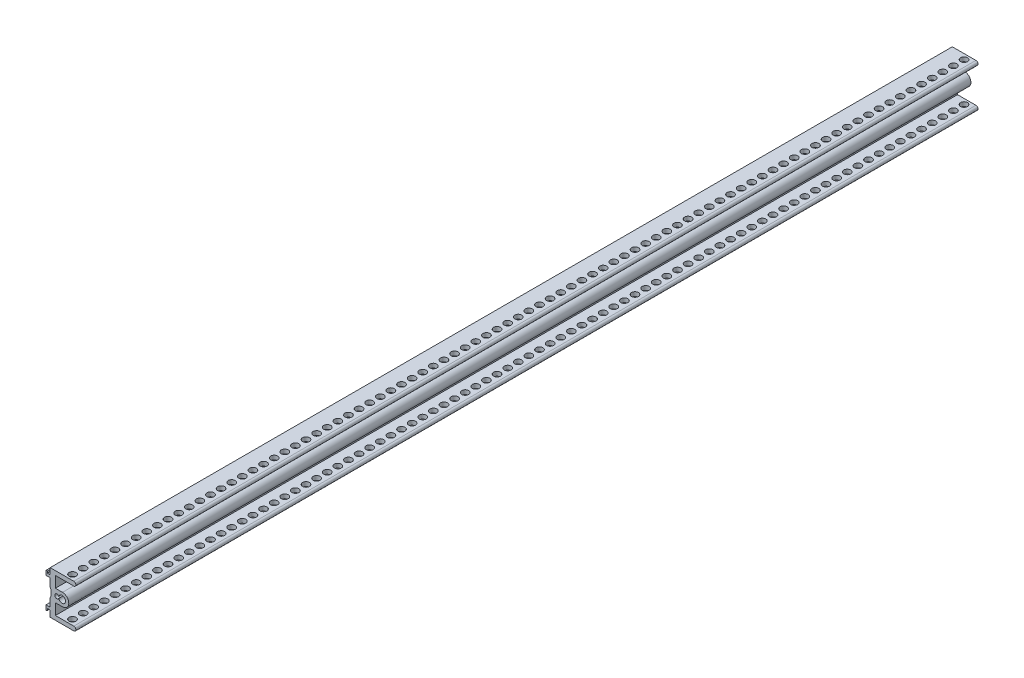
SolidWorks part; units mm, degrees
ref_plane "前视基准面" through (0, 0, 0) normal (0, 0, 1) x (1, 0, 0)
ref_plane "上视基准面" through (0, 0, 0) normal (0, 1, 0) x (1, 0, 0)
ref_plane "右视基准面" through (0, 0, 0) normal (1, 0, 0) x (0, 0, -1)
sketch "草图1" plane through (0, 0, 0) normal (0, 0, 1) x (1, 0, 0)
  line L0 (-4.15, 8.3) -> (-4.15, 3)
  line L1 (-6.65, 10.3) -> (4.65, 10.3)
  line L2 (-6.65, 7.3) -> (-8.05, 7.3)
  line L3 (4.65, 8.3) -> (-4.15, 8.3)
  line L4 (-6.65, -6.1) -> (-6.65, -2.0884)
  line L5 (-6.65, 2.1116) -> (-6.35, 1.5116)
  line L6 (-0.75, 0) -> (3.3598, 0) construction
  line L7 (-6.65, -7.3) -> (-6.65, -10.3)
  line L8 (-8.65, -8.0782) -> (-8.65, -6.1)
  line L9 (-6.65, -6.1) -> (-8.65, -6.1)
  line L10 (-8.05, -8.0782) -> (-8.05, -7.3)
  line L11 (-6.65, -2.0884) -> (-6.35, -1.4884)
  line L12 (-6.65, 2.1116) -> (-6.65, 6.1)
  line L13 (4.65, -8.3) -> (-4.15, -8.3)
  line L14 (-6.65, -10.3) -> (4.65, -10.3)
  line L15 (-4.15, -8.3) -> (-4.15, -3)
  line L16 (-6.35, 1.5116) -> (-6.35, -1.4884)
  line L17 (-4.15, 3) -> (-0.75, 3)
  line L18 (-8.05, 8.0782) -> (-8.05, 7.3)
  line L19 (-0.75, -3) -> (-4.15, -3)
  line L20 (-6.65, 6.1) -> (-8.65, 6.1)
  line L21 (-8.65, 8.0782) -> (-8.65, 6.1)
  line L22 (-6.65, -7.3) -> (-8.05, -7.3)
  line L23 (-8.35, -8.3782) -> (-9.7583, -8.3782) construction
  line L24 (-8.35, 8.3782) -> (-9.5309, 8.3782) construction
  line L25 (-6.65, 7.3) -> (-6.65, 10.3)
  arc A0 (-8.65, 8.0782) -> (-8.05, 8.0782) centre (-8.35, 8.0782) cw
  arc A4 (4.65, -8.3) -> (4.65, -10.3) centre (4.65, -9.3) cw
  arc A6 (-8.65, -8.0782) -> (-8.05, -8.0782) centre (-8.35, -8.0782) ccw
  arc A8 (4.65, 8.3) -> (4.65, 10.3) centre (4.65, 9.3) ccw
  arc A10 (-0.75, 3) -> (-0.75, -3) centre (-0.75, 0) cw
  arc A11 (-2.5445, -0.4243) -> (-2.5445, 0.4243) centre (-0.95, 0) ccw
  arc A12 (-2.5445, 0.4243) -> (-2.5445, -0.4243) centre (-3.45, 0) ccw
  dimension "D4" = 1.4
  dimension "D12" = 16.7565
  dimension "D3" = 0.3
  dimension "D8" = 7.7
  dimension "D5" = 2
  dimension "D6" = 0.3
  dimension "D7" = 2
  dimension "D11" = 1
  dimension "D1" = 1.2
  dimension "D2" = 3
  dimension "D9" = 13.3
  dimension "D10" = 13.3
extrude "凸台-拉伸1" add sketch "草图1" along normal mid plane 431.8
sketch "草图3" plane through (0, -10.3, 0) normal (0, -1, 0) x (1, 0, 0)
  line L0 (-6.65, 215.9) -> (4.65, 215.9) construction
  line L2 (4.65, 215.9) -> (4.65, -215.9) construction
  circle A0 centre (1.5, 213.36) radius 1.65
  circle A1 centre (1.5, 208.28) radius 1.65
  circle A2 centre (1.5, 203.2) radius 1.65
  circle A3 centre (1.5, 198.12) radius 1.65
  circle A4 centre (1.5, 193.04) radius 1.65
  circle A5 centre (1.5, 187.96) radius 1.65
  circle A6 centre (1.5, 182.88) radius 1.65
  circle A7 centre (1.5, 177.8) radius 1.65
  circle A8 centre (1.5, 172.72) radius 1.65
  circle A9 centre (1.5, 167.64) radius 1.65
  circle A10 centre (1.5, 162.56) radius 1.65
  circle A11 centre (1.5, 157.48) radius 1.65
  circle A12 centre (1.5, 152.4) radius 1.65
  circle A13 centre (1.5, 147.32) radius 1.65
  circle A14 centre (1.5, 142.24) radius 1.65
  circle A15 centre (1.5, 137.16) radius 1.65
  circle A16 centre (1.5, 132.08) radius 1.65
  circle A17 centre (1.5, 127) radius 1.65
  circle A18 centre (1.5, 121.92) radius 1.65
  circle A19 centre (1.5, 116.84) radius 1.65
  circle A20 centre (1.5, 111.76) radius 1.65
  circle A21 centre (1.5, 106.68) radius 1.65
  circle A22 centre (1.5, 101.6) radius 1.65
  circle A23 centre (1.5, 96.52) radius 1.65
  circle A24 centre (1.5, 91.44) radius 1.65
  circle A25 centre (1.5, 86.36) radius 1.65
  circle A26 centre (1.5, 81.28) radius 1.65
  circle A27 centre (1.5, 76.2) radius 1.65
  circle A28 centre (1.5, 71.12) radius 1.65
  circle A29 centre (1.5, 66.04) radius 1.65
  circle A30 centre (1.5, 60.96) radius 1.65
  circle A31 centre (1.5, 55.88) radius 1.65
  circle A32 centre (1.5, 50.8) radius 1.65
  circle A33 centre (1.5, 45.72) radius 1.65
  circle A34 centre (1.5, 40.64) radius 1.65
  circle A35 centre (1.5, 35.56) radius 1.65
  circle A36 centre (1.5, 30.48) radius 1.65
  circle A37 centre (1.5, 25.4) radius 1.65
  circle A38 centre (1.5, 20.32) radius 1.65
  circle A39 centre (1.5, 15.24) radius 1.65
  circle A40 centre (1.5, 10.16) radius 1.65
  circle A41 centre (1.5, 5.08) radius 1.65
  circle A42 centre (1.5, 0) radius 1.65
  circle A43 centre (1.5, -5.08) radius 1.65
  circle A44 centre (1.5, -10.16) radius 1.65
  circle A45 centre (1.5, -15.24) radius 1.65
  circle A46 centre (1.5, -20.32) radius 1.65
  circle A47 centre (1.5, -25.4) radius 1.65
  circle A48 centre (1.5, -30.48) radius 1.65
  circle A49 centre (1.5, -35.56) radius 1.65
  circle A50 centre (1.5, -40.64) radius 1.65
  circle A51 centre (1.5, -45.72) radius 1.65
  circle A52 centre (1.5, -50.8) radius 1.65
  circle A53 centre (1.5, -55.88) radius 1.65
  circle A54 centre (1.5, -60.96) radius 1.65
  circle A55 centre (1.5, -66.04) radius 1.65
  circle A56 centre (1.5, -71.12) radius 1.65
  circle A57 centre (1.5, -76.2) radius 1.65
  circle A58 centre (1.5, -81.28) radius 1.65
  circle A59 centre (1.5, -86.36) radius 1.65
  circle A60 centre (1.5, -91.44) radius 1.65
  circle A61 centre (1.5, -96.52) radius 1.65
  circle A62 centre (1.5, -101.6) radius 1.65
  circle A63 centre (1.5, -106.68) radius 1.65
  circle A64 centre (1.5, -111.76) radius 1.65
  circle A65 centre (1.5, -116.84) radius 1.65
  circle A66 centre (1.5, -121.92) radius 1.65
  circle A67 centre (1.5, -127) radius 1.65
  circle A68 centre (1.5, -132.08) radius 1.65
  circle A69 centre (1.5, -137.16) radius 1.65
  circle A70 centre (1.5, -142.24) radius 1.65
  circle A71 centre (1.5, -147.32) radius 1.65
  circle A72 centre (1.5, -152.4) radius 1.65
  circle A73 centre (1.5, -157.48) radius 1.65
  circle A74 centre (1.5, -162.56) radius 1.65
  circle A75 centre (1.5, -167.64) radius 1.65
  circle A76 centre (1.5, -172.72) radius 1.65
  circle A77 centre (1.5, -177.8) radius 1.65
  circle A78 centre (1.5, -182.88) radius 1.65
  circle A79 centre (1.5, -187.96) radius 1.65
  circle A80 centre (1.5, -193.04) radius 1.65
  circle A81 centre (1.5, -198.12) radius 1.65
  circle A82 centre (1.5, -203.2) radius 1.65
  circle A83 centre (1.5, -208.28) radius 1.65
  circle A84 centre (1.5, -213.36) radius 1.65
  dimension "D1" = 3.3
  dimension "D2" = 3.15
  dimension "D4" = 85
  dimension "D3" = 2.54
extrude "切除-拉伸1" cut sketch "草图3" against normal blind 2.5
mirror "镜向1" about plane through (0, 0, 0) normal (0, 1, 0) of "切除-拉伸1"
